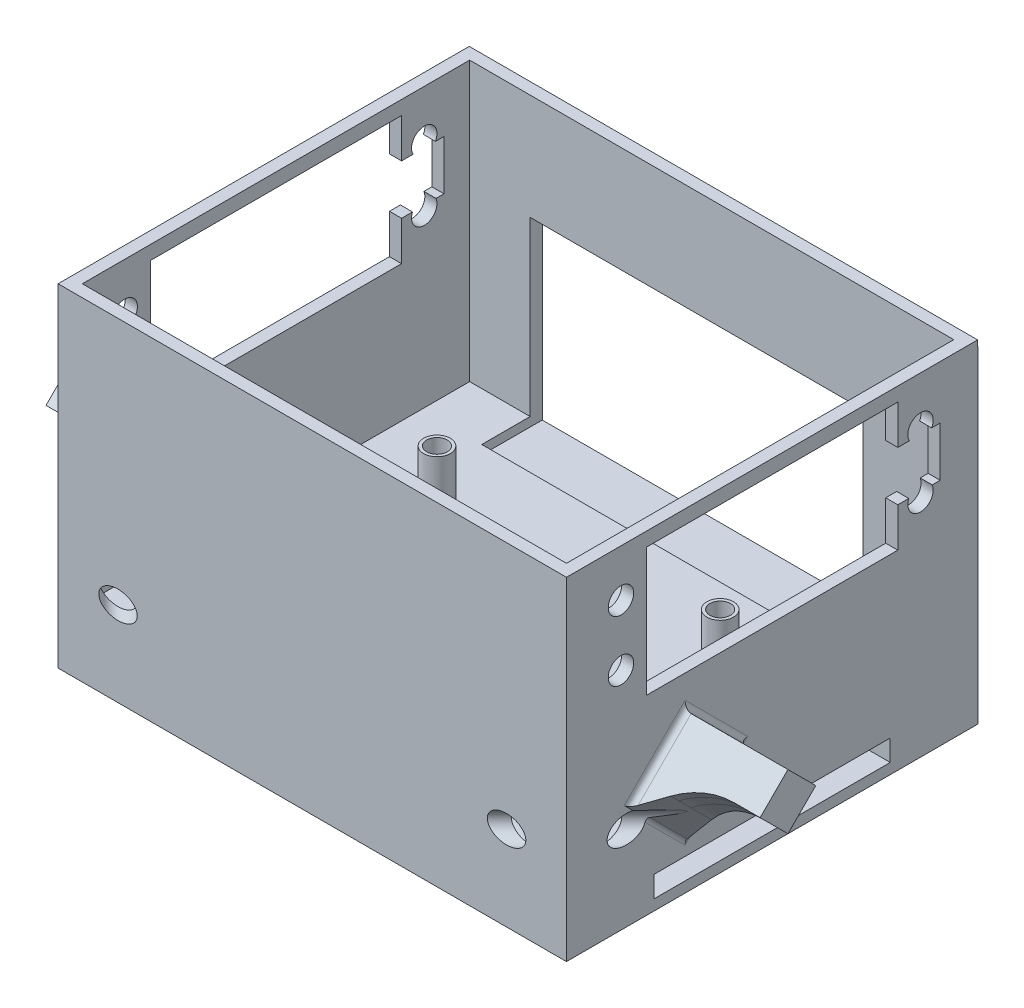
SolidWorks part; units mm, degrees
ref_plane "Front Plane" through (0, 0, 0) normal (0, 0, 1) x (1, 0, 0)
ref_plane "Top Plane" through (0, 0, 0) normal (0, 1, 0) x (1, 0, 0)
ref_plane "Right Plane" through (0, 0, 0) normal (1, 0, 0) x (0, 0, -1)
sketch "Sketch1" plane through (0, 0, 0) normal (0, 1, 0) x (1, 0, 0)
  line L0 (0, 0) -> (80, 0)
  line L1 (80, 0) -> (80, -64)
  line L2 (80, -64) -> (0, -64)
  line L3 (0, -64) -> (0, 0)
  dimension "D1" = 80
  dimension "D2" = 64
extrude "Boss-Extrude1" add sketch "Sketch1" along normal blind 45
shell "Shell1" thickness 2
ref_plane "Plane1" through (0, 0, 0) normal (0, 1, 0) x (1, 0, 0)
sketch "Sketch2" plane through (0, 0, 0) normal (0, 1, 0) x (1, 0, 0)
  line L0 (0, 0) -> (0, -64) construction
  line L5 (0, -64) -> (80, -64) construction
  circle A2 centre (61.8, -44) radius 2.2
  circle A3 centre (15, -44) radius 2.2
  circle A6 centre (61.8, -44) radius 1.7
  circle A7 centre (15, -44) radius 1.7
  circle A8 centre (15, -20.4) radius 1.7
  circle A9 centre (15, -20.4) radius 2.2
  circle A10 centre (61.8, -20.4) radius 1.7
  circle A11 centre (61.8, -20.4) radius 2.2
  dimension "D2" = 46.8
  dimension "D5" = 4.4
  dimension "D6" = 3.4
  dimension "D3" = 15
  dimension "D4" = 2
  dimension "D9" = 20
  dimension "D10" = 20
extrude "Boss-Extrude2" add sketch "Sketch2" along normal blind 8.5
ref_plane "Plane3" through (0, 45, 0) normal (0, 1, 0) x (1, 0, 0)
ref_plane "Plane4" through (0, 14.4, 0) normal (0, 1, 0) x (1, 0, 0)
ref_plane "Plane5" through (0, 0, -2) normal (0, 0, -1) x (-1, 0, 0)
sketch "Sketch10" plane through (0, 0, -2) normal (0, 0, -1) x (-1, 0, 0)
  line L0 (-82, 45) -> (-82, -2) construction
  line L1 (-82, -2) -> (2, -2) construction
  line L2 (2, 45) -> (2, -2) construction
  circle A0 centre (-15.5, 17) radius 3
  circle A1 centre (-50.75, 17) radius 3
  dimension "D1" = 6
  dimension "D2" = 31.25
  dimension "D3" = 19
  dimension "D4" = 19
  dimension "D5" = 17.5
extrude "Cut-Extrude3" cut sketch "Sketch10" against normal blind 10
ref_plane "Plane6" through (82, 0, 0) normal (1, 0, 0) x (0, 0, -1)
sketch "Sketch11" plane through (82, 0, 0) normal (1, 0, 0) x (0, 0, -1)
  line L4 (-52.75, 22.5) -> (-52.75, 43.7)
  line L5 (-52.75, 43.7) -> (-11.25, 43.7)
  line L6 (-11.25, 43.7) -> (-11.25, 37.2)
  line L7 (-11.25, 37.2) -> (-4.25, 37.2)
  line L8 (-4.25, 37.2) -> (-4.25, 29)
  line L9 (-4.25, 29) -> (-11.25, 29)
  line L10 (-11.25, 29) -> (-11.25, 22.5)
  line L11 (-11.25, 22.5) -> (-52.75, 22.5)
  line L12 (-66, -2) -> (2, -2) construction
  line L13 (-66, 45) -> (-66, -2) construction
  line L14 (-52.75, 33.1) -> (-66, 33.1) construction
  line L15 (-11.25, 37.2) -> (-11.25, 29) construction
  line L16 (-11.25, 33.1) -> (2, 33.1) construction
  line L17 (2, -29.7) -> (2, 29.7) construction
  dimension "D1" = 41.5
  dimension "D2" = 21.2
  dimension "D3" = 6.5
  dimension "D4" = 24.5
  dimension "D5" = 7
extrude "Cut-Extrude4" cut sketch "Sketch11" against normal through all
ref_plane "Plane7" through (8, 0, -8) normal (0.7071, 0, -0.7071) x (-0.7071, 0, -0.7071)
ref_plane "Plane8" through (50.4264, 0, -50.4264) normal (0.7071, 0, -0.7071) x (-0.7071, 0, -0.7071)
sketch "Sketch12" plane through (50.4264, 0, -50.4264) normal (0.7071, 0, -0.7071) x (-0.7071, 0, -0.7071)
  line L0 (-104.6518, -2) -> (-56.5685, -2) construction
  line L1 (-104.6518, 45) -> (-104.6518, -2) construction
  circle A0 centre (-97.6518, 5) radius 2.25
  dimension "D3" = 4.5
  dimension "D1" = 7
  dimension "D2" = 7
extrude "Cut-Extrude5" cut sketch "Sketch12" against normal through all
ref_plane "Plane9" through (32, 0, 32) normal (0.7071, 0, 0.7071) x (0.7071, 0, -0.7071)
ref_plane "Plane10" through (-10.4264, 0, -10.4264) normal (-0.7071, 0, -0.7071) x (-0.7071, 0, 0.7071)
sketch "Sketch14" plane through (-10.4264, 0, -10.4264) normal (-0.7071, 0, -0.7071) x (-0.7071, 0, 0.7071)
  line L0 (48.0833, 45) -> (48.0833, -2) construction
  line L1 (0, -2) -> (48.0833, -2) construction
  circle A0 centre (41.0833, 5) radius 2.25
  dimension "D3" = 4.5
  dimension "D1" = 7
  dimension "D2" = 7
extrude "Cut-Extrude6" cut sketch "Sketch14" against normal through all
ref_plane "Plane11" through (-2, 0, 0) normal (-1, 0, 0) x (0, 0, 1)
sketch "Sketch15" plane through (-2, 0, 0) normal (-1, 0, 0) x (0, 0, 1)
  line L0 (46.4038, 17.1924) -> (41.8076, 12.5962)
  line L1 (41.8076, 12.5962) -> (46.4038, 8)
  line L2 (46.4038, 8) -> (51, 12.5962)
  line L3 (51, 12.5962) -> (46.4038, 17.1924)
  line L4 (66, 45) -> (66, -2) construction
  line L5 (-2, -2) -> (66, -2) construction
  line L6 (46.4038, 17.1924) -> (46.4038, 8) construction
  dimension "D1" = 6.5
  dimension "D2" = 15
  dimension "D3" = 10
extrude "Boss-Extrude4" add sketch "Sketch15" along normal blind 17
sketch "Sketch16" plane through (82, 0, 0) normal (1, 0, 0) x (0, 0, -1)
  line L0 (-46.4038, 17.1924) -> (-51, 12.5962)
  line L1 (-51, 12.5962) -> (-46.4038, 8)
  line L2 (-46.4038, 8) -> (-41.8076, 12.5962)
  line L3 (-41.8076, 12.5962) -> (-46.4038, 17.1924)
  line L4 (-46.4038, 17.1924) -> (-46.4038, 8) construction
  line L5 (-66, -2) -> (2, -2) construction
  line L6 (-66, 45) -> (-66, -2) construction
  dimension "D1" = 6.5
  dimension "D2" = 10
  dimension "D3" = 15
extrude "Boss-Extrude5" add sketch "Sketch16" along normal blind 17
chamfer "Chamfer1" distance 8 angle 40 4 edges at (82, 10.2981, 48.7019) (82, 10.2981, 44.1057) (-2, 10.2981, 44.1057) (-2, 10.2981, 48.7019)
ref_plane "Plane12" through (0, -25.2123, 25.2123) normal (0, -0.7071, 0.7071) x (1, 0, 0)
sketch "Sketch18" plane through (0, -25.2123, 25.2123) normal (0, -0.7071, 0.7071) x (1, 0, 0)
  line L0 (-19, 38.4693) -> (-19, 44.9693) construction
  line L1 (99, 44.9693) -> (99, 38.4693) construction
  line L4 (-16.5, 41.7193) -> (-16.5, 44.9693) construction
  line L5 (-19, 44.9693) -> (-10, 44.9693) construction
  line L6 (-16.5, 41.7193) -> (-16.5, 38.4693) construction
  line L8 (-19, 38.4693) -> (-10, 38.4693) construction
  line L9 (96.5, 41.7193) -> (96.5, 44.9693) construction
  line L10 (99, 44.9693) -> (90, 44.9693) construction
  line L11 (96.5, 41.7193) -> (96.5, 38.4693) construction
  line L12 (99, 38.4693) -> (90, 38.4693) construction
  circle A0 centre (96.5, 41.7193) radius 2.25
  circle A1 centre (-16.5, 41.7193) radius 2.25
  dimension "D1" = 4.5
  dimension "D2" = 2.5
  dimension "D3" = 2.5
extrude "Cut-Extrude7" cut sketch "Sketch18" against normal offset from surface (13.5 mm away) 1.5
sketch "Sketch19" plane through (0, -25.2123, 25.2123) normal (0, -0.7071, 0.7071) x (1, 0, 0)
  circle A0 centre (96.5, 41.7193) radius 0.5
  circle A1 centre (-16.5, 41.7193) radius 0.5
  dimension "D1" = 1
extrude "Cut-Extrude8" cut sketch "Sketch19" against normal through all
fillet "Fillet4" radius 13 4 edges at (-10, 10.2981, 44.1057) (-10, 10.2981, 48.7019) (90, 10.2981, 44.1057) (90, 10.2981, 48.7019)
fillet "Fillet1" radius 1 2 edges at (-16.5, 14.5407, 43.7522) (96.5, 14.5407, 43.7522)
ref_plane "Plane13" through (0, -2, 0) normal (0, -1, 0) x (-1, 0, 0)
sketch "Sketch20" plane through (0, -2, 0) normal (0, -1, 0) x (-1, 0, 0)
  line L0 (13.39, 29.39) -> (-29.39, -13.39) construction
  line L1 (-82, -66) -> (2, -66)
  line L2 (-82, -66) -> (-82, 2)
  line L3 (-82, 2) -> (2, 2)
  line L4 (2, -66) -> (2, 2)
  line L5 (2, -66) -> (-82, -66) construction
  line L6 (2, -30.25) -> (2, 30.25) construction
  line L7 (29.7, 2) -> (-29.7, 2) construction
extrude "Boss-Extrude6" add sketch "Sketch20" along normal blind 7
sketch "Sketch21" plane through (82, 0, 0) normal (1, 0, 0) x (0, 0, -1)
  line L0 (2, -9) -> (-66, -9) construction
  line L1 (-51.5, -7.25) -> (-12.5, -7.25)
  line L2 (-51.5, -7.25) -> (-51.5, -3.75)
  line L3 (-51.5, -3.75) -> (-12.5, -3.75)
  line L4 (-12.5, -7.25) -> (-12.5, -3.75)
  line L5 (-51.5, -5.5) -> (-66, -5.5) construction
  line L6 (-66, 45) -> (-66, -9) construction
  line L7 (-12.5, -5.5) -> (2, -5.5) construction
  line L8 (2, -29.7) -> (2, 29.7) construction
  dimension "D1" = 39
  dimension "D2" = 3.5
  dimension "D3" = 1.75
extrude "Cut-Extrude9" cut sketch "Sketch21" against normal through all
sketch "Sketch22" plane through (0, 45, 0) normal (0, 1, 0) x (1, 0, 0)
  line L0 (-2, 30.25) -> (-2, -30.25) construction
  line L1 (-2, -66) -> (82, -66)
  line L2 (-2, -66) -> (-2, 1.9366)
  line L3 (-2, 1.9366) -> (82, 1.9366)
  line L4 (82, -66) -> (82, 1.9366)
  line L5 (-2, -66) -> (82, -66) construction
  line L6 (82, -30.25) -> (82, 30.25) construction
  line L7 (10.61, -53.39) -> (53.39, -10.61) construction
  line L8 (0, -64) -> (80, -64)
  line L9 (0, -64) -> (0, 0)
  line L10 (0, 0) -> (80, 0)
  line L11 (80, -64) -> (80, 0)
  line L12 (0, -64) -> (80, -64) construction
extrude "Boss-Extrude7" add sketch "Sketch22" along normal blind 1
sketch "Sketch23" plane through (0, 0, -2) normal (0, 0, -1) x (-1, 0, 0)
  line L0 (2, -9) -> (-82, -9) construction
  line L1 (-45.5, -1) -> (-34.5, -1)
  line L2 (-45.5, -1) -> (-45.5, 7)
  line L3 (-45.5, 7) -> (-34.5, 7)
  line L4 (-34.5, -1) -> (-34.5, 7)
  line L5 (-45.5, 1.6) -> (-34.5, 1.6) construction
  line L6 (-45.5, 4.4) -> (-34.5, 4.4) construction
  line L7 (-81, -9) -> (-81, 0) construction
  line L8 (-81, 0) -> (-51, 0) construction
  line L9 (-51, 0) -> (-51, -9) construction
  line L10 (-82, 30.25) -> (-82, -30.25) construction
  line L11 (-45.5, 3) -> (-82, 3) construction
  line L12 (-34.5, 3) -> (2, 3) construction
  line L13 (2, -30.25) -> (2, 30.25) construction
  dimension "D1" = 11
  dimension "D2" = 8
  dimension "D3" = 8
  dimension "D4" = 2.6
  dimension "D5" = 2.6
  dimension "D6" = 30
  dimension "D7" = 9
  dimension "D9" = 1
extrude "Cut-Extrude10" cut sketch "Sketch23" against normal blind 2
fillet "Fillet2" radius 1 8 edges at (-2, 12.521, 51.0752) (-2, 12.521, 41.7324) (82, 12.521, 41.7324) (82, 12.521, 51.0752) (82, 3.701, 58.6986) (82, 3.1781, 41.7324) (-2, 3.1781, 41.7324) (85.7165, 6.299, 49.7859)
fillet "Fillet3" radius 0.5 4 edges at (40, 7, -2) (45.5, 3, -2) (40, -1, -2) (34.5, 3, -2)
sketch "Sketch24" plane through (82, 0, 0) normal (1, 0, 0) x (0, 0, -1)
  line L1 (-11.25, 43.7) -> (-52.75, 43.7) construction
  line L3 (-52.75, 43.7) -> (-52.75, 22.5) construction
  circle A0 centre (-57, 38.2) radius 2.1
  circle A1 centre (-57, 28.2) radius 2.1
  circle A2 centre (-7.5, 28.2) radius 2.1
  circle A3 centre (-7.5, 38.2) radius 2.1
  point P10 (-57.5488, 28.4734)
  dimension "D1" = 4.2
  dimension "D2" = 4.2
  dimension "D3" = 4.2
  dimension "D4" = 4.2
  dimension "D5" = 49.5
  dimension "D6" = 49.5
  dimension "D7" = 10
  dimension "D8" = 5.5
  dimension "D9" = 4.25
  dimension "D10" = 4.25
  dimension "D11" = 10
  dimension "D12" = 5.5
extrude "Cut-Extrude11" cut sketch "Sketch24" against normal through all
sketch "Sketch25" plane through (0, 0, -2) normal (0, 0, -1) x (-1, 0, 0)
  line L0 (2, -9) -> (-82, -9) construction
  line L1 (-65, 28.5) -> (-10, 28.5)
  line L2 (-65, 28.5) -> (-65, -1.5)
  line L3 (-65, -1.5) -> (-10, -1.5)
  line L4 (-10, 28.5) -> (-10, -1.5)
  line L5 (2, 45) -> (2, -9) construction
  dimension "D1" = 55
  dimension "D2" = 30
  dimension "D3" = 7.5
  dimension "D4" = 12
extrude "Cut-Extrude12" cut sketch "Sketch25" against normal blind 10
